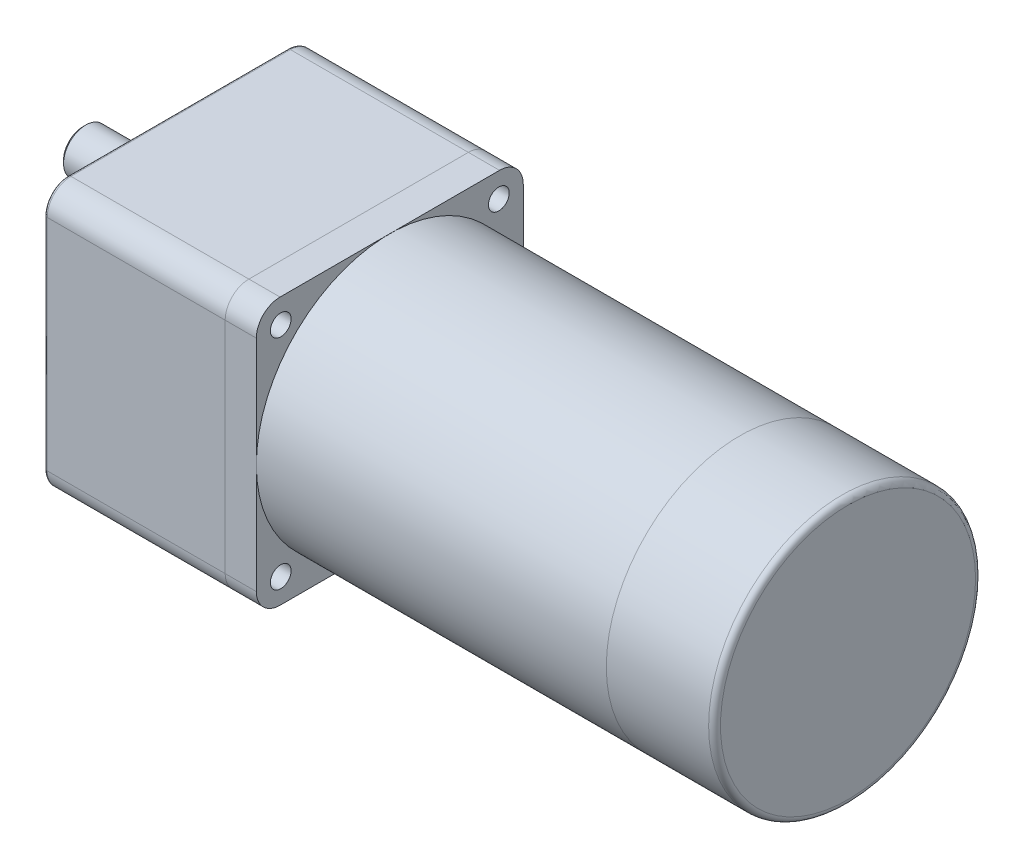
SolidWorks part; units mm, degrees
ref_plane "前视基准面" through (0, 0, 0) normal (0, 0, 1) x (1, 0, 0)
ref_plane "上视基准面" through (0, 0, 0) normal (0, 1, 0) x (1, 0, 0)
ref_plane "右视基准面" through (0, 0, 0) normal (1, 0, 0) x (0, 0, -1)
sketch "草图1" plane through (0, 0, 0) normal (1, 0, 0) x (0, 0, -1)
  line L1 (-37, -45) -> (37, -45)
  line L2 (-45, -37) -> (-45, 37)
  line L3 (-37, 45) -> (37, 45)
  line L4 (45, -37) -> (45, 37)
  line L5 (-45, -45) -> (45, 45) construction
  line L6 (-45, 45) -> (45, -45) construction
  arc A0 (-37, -45) -> (-45, -37) centre (-37, -37) cw
  arc A1 (37, -45) -> (45, -37) centre (37, -37) ccw
  arc A2 (37, 45) -> (45, 37) centre (37, 37) cw
  arc A3 (-45, 37) -> (-37, 45) centre (-37, 37) cw
  point P0 (0, 0)
  dimension "D1" = 8
extrude "凸台-拉伸1" add sketch "草图1" along normal blind 61
sketch "草图2" plane through (61, 0, 0) normal (1, 0, 0) x (0, 0, -1)
  line L0 (37, 45) -> (-37, 45) construction
  line L1 (-37, -45) -> (37, -45)
  line L2 (-45, -37) -> (-45, 37)
  line L3 (-37, 45) -> (37, 45)
  line L4 (45, -37) -> (45, 37)
  line L5 (-45, -45) -> (45, 45) construction
  line L6 (-45, 45) -> (45, -45) construction
  arc A0 (37, 45) -> (45, 37) centre (37, 37) cw
  arc A1 (37, -45) -> (45, -37) centre (37, -37) ccw
  arc A2 (-37, -45) -> (-45, -37) centre (-37, -37) cw
  arc A3 (-45, 37) -> (-37, 45) centre (-37, 37) cw
  point P0 (0, 0)
  dimension "D1" = 8
extrude "凸台-拉伸2" add sketch "草图2" along normal blind 10.5 separate body
fillet "圆角1" radius 1 8 edges at (0, -45, 0) (0, -42.6569, -42.6569) (0, 0, -45) (0, 42.6569, -42.6569) (0, 45, 0) (0, 42.6569, 42.6569) (0, 0, 45) (0, -42.6569, 42.6569)
sketch "草图6" plane through (0, 0, 0) normal (-1, 0, 0) x (0, 0, 1)
  circle A0 centre (0, 18) radius 16
extrude "凸台-拉伸5" add sketch "草图6" along normal blind 3 separate body
fillet "圆角3" radius 0.5 1 edges at (-3, 18, 16)
sketch "草图7" plane through (-3, 0, 0) normal (-1, 0, 0) x (0, 0, 1)
  circle A0 centre (0, 18) radius 7.5
extrude "凸台-拉伸6" add sketch "草图7" along normal blind 29 separate body
ref_plane "基准面1" through (0, 0, -7.5) normal (0, 0, 1) x (1, 0, 0)
sketch "草图8" plane through (0, 0, -7.5) normal (0, 0, 1) x (1, 0, 0)
  line L1 (-32, 25.5) -> (-32, 10.5) construction
  line L2 (-9.5, 20.5) -> (-32, 20.5)
  line L3 (-32, 20.5) -> (-32, 15.5)
  line L4 (-32, 15.5) -> (-9.5, 15.5)
  arc A0 (-9.5, 15.5) -> (-9.5, 20.5) centre (-9.5, 18) ccw
extrude "切除-拉伸2" cut sketch "草图8" along normal blind 3
chamfer "倒角2" distance 1 angle 45 1 edges at (-32, 18, 7.5)
sketch "草图9" plane through (0, 0, 0) normal (-1, 0, 0) x (0, 0, 1)
  circle A0 centre (0, 0) radius 41.4
extrude "切除-拉伸3" cut sketch "草图9" against normal blind 0.5
fillet "圆角4" radius 0.5 1 edges at (0, 0, 41.4)
sketch "草图10" plane through (0, 0, 0) normal (-1, 0, 0) x (0, 0, 1)
  point P19 (-36.7696, 36.7696)
  point P20 (36.7696, 36.7696)
  point P21 (36.7696, -36.7696)
  point P22 (-36.7696, -36.7696)
hole_wizard "M6 螺纹孔1" positions "3D草图1" profile "草图11" tap size "M6" standard "GB"
sketch3d "3D草图1"
  point P0 (0, 36.7696, -36.7696)
  point P3 (0, 36.7696, 36.7696)
  point P6 (0, -36.7696, 36.7696)
  point P9 (0, -36.7696, -36.7696)
sketch "草图11" plane through (0, 36.7696, -36.7696) normal (0, 1, 0) x (0, 0, 1)
  line L0 (0, 0) -> (0, 18.5022)
  line L1 (0, 18.5022) -> (2.5, 17)
  line L2 (2.5, 17) -> (2.5, 0)
  line L5 (2.5, 0) -> (0, 0)
  line L10 (0, 18.5022) -> (-2.5, 17) construction
  line L11 (0, -6.35) -> (0, 107.95) construction
  dimension "螺纹孔钻头直径" = 5
  dimension "螺纹孔钻头深度" = 17
  dimension "导头角度" = 118
sketch "草图13" plane through (71.5, 0, 0) normal (1, 0, 0) x (0, 0, -1)
  circle A0 centre (-36.7696, 36.7696) radius 3.5
  circle A1 centre (36.7696, 36.7696) radius 3.5
  circle A2 centre (36.7696, -36.7696) radius 3.5
  circle A3 centre (-36.7696, -36.7696) radius 3.5
extrude "切除-拉伸4" cut sketch "草图13" against normal blind 62
fillet "圆角5" radius 1 4 edges at (0, -36.7696, -34.2696) (0, -36.7696, 39.2696) (0, 36.7696, 39.2696) (0, 36.7696, -34.2696)
sketch "草图14" plane through (71.5, 0, 0) normal (1, 0, 0) x (0, 0, -1)
  circle A0 centre (0, 0) radius 45
extrude "凸台-拉伸7" add sketch "草图14" along normal blind 118 separate body
sketch "草图15" plane through (189.5, 0, 0) normal (1, 0, 0) x (0, 0, -1)
  circle A0 centre (0, 0) radius 45
extrude "凸台-拉伸8" add sketch "草图15" along normal blind 36.5 separate body
fillet "圆角6" radius 2 1 edges at (226, 0, -45)
